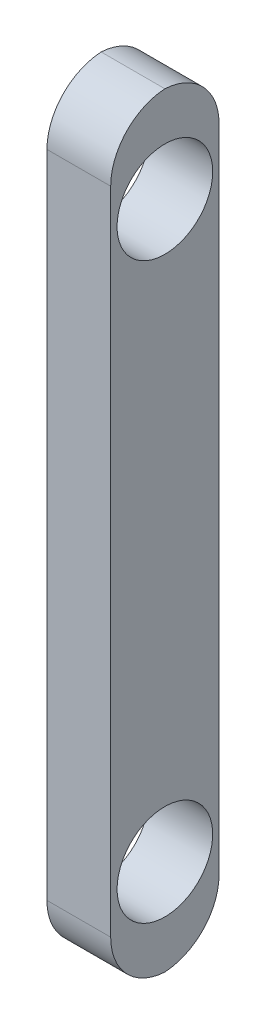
SolidWorks part; units mm, degrees
ref_plane "Front Plane" through (0, 0, 0) normal (0, 0, 1) x (1, 0, 0)
ref_plane "Top Plane" through (0, 0, 0) normal (0, 1, 0) x (1, 0, 0)
ref_plane "Right Plane" through (0, 0, 0) normal (1, 0, 0) x (0, 0, -1)
sketch "Sketch2" plane through (0, 0, 0) normal (1, 0, 0) x (0, 0, -1)
  line L0 (3.7022, 0) -> (7.1022, 0)
  line L1 (7.1022, 0) -> (7.1022, -24)
  line L2 (7.1022, -24) -> (3.7022, -24)
  line L3 (3.7022, -24) -> (3.7022, 0)
  dimension "28" = 24
  dimension "D2" = 3.4
extrude "Boss-Extrude1" add sketch "Sketch2" along normal blind 2
sketch "Sketch3" plane through (2, 0, 0) normal (1, 0, 0) x (0, 0, -1)
  line L0 (5.4022, 0) -> (5.4022, -24) construction
  line L1 (7.1022, 0) -> (3.7022, 0) construction
  line L2 (3.7022, -24) -> (7.1022, -24) construction
  line L3 (3.7022, 0) -> (3.7022, -3) construction
  line L4 (3.7022, 0) -> (3.7022, -24) construction
  line L5 (3.7022, -3) -> (5.4022, -3) construction
  line L6 (3.7022, -12) -> (7.1022, -12) construction
  line L7 (7.1022, -24) -> (7.1022, 0) construction
  circle A0 centre (5.4022, -3) radius 1.5
  circle A1 centre (5.4022, -21) radius 1.5
  dimension "D2" = 3
  dimension "D1" = 3
extrude "Cut-Extrude1" cut sketch "Sketch3" against normal blind 2
fillet "Fillet1" radius 1.8 4 edges at (1, -24, -7.1022) (1, -24, -3.7022) (1, 0, -3.7022) (1, 0, -7.1022)
